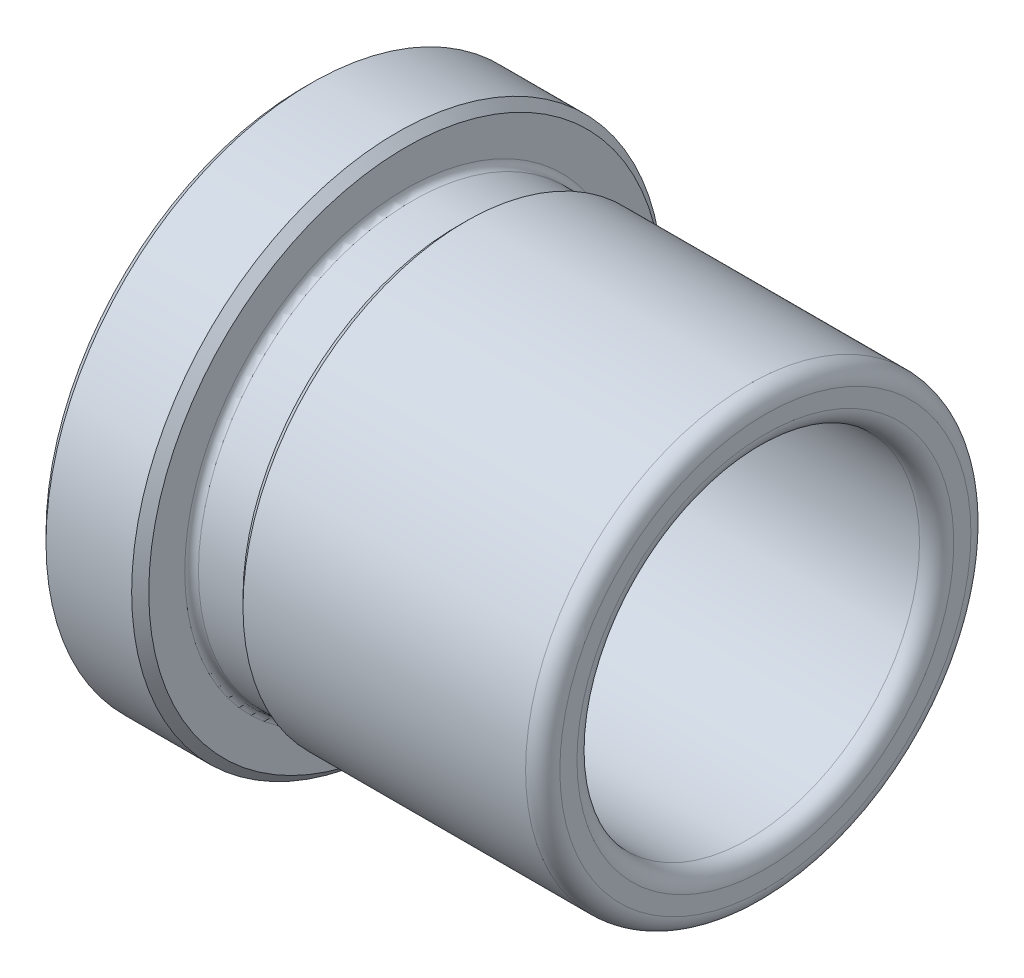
SolidWorks part; units mm, degrees
ref_plane "Plano frontal" through (0, 0, 0) normal (0, 0, 1) x (1, 0, 0)
ref_plane "Plano superior" through (0, 0, 0) normal (0, 1, 0) x (1, 0, 0)
ref_plane "Plano direito" through (0, 0, 0) normal (1, 0, 0) x (0, 0, -1)
sketch "Esboço1" plane through (0, 0, 0) normal (0, 0, 1) x (1, 0, 0)
  line L0 (0, 11) -> (0, 15)
  line L1 (0, 15) -> (0.5, 15.5)
  line L2 (0.5, 15.5) -> (5.5, 15.5)
  line L3 (5.5, 15.5) -> (6, 15)
  line L4 (6, 15) -> (6, 12.9)
  line L5 (6.4, 12.5) -> (9, 12.5)
  line L6 (9, 12.5) -> (9.5, 13)
  line L7 (9.5, 13) -> (26, 13)
  line L8 (27, 12) -> (27, 11)
  line L9 (26, 10) -> (1, 10)
  line L10 (0, 0) -> (32.5681, 0) construction
  arc A0 (6.4, 12.5) -> (6, 12.9) centre (6.4, 12.9) cw
  arc A1 (26, 13) -> (27, 12) centre (26, 12) cw
  arc A2 (27, 11) -> (26, 10) centre (26, 11) cw
  arc A3 (0, 11) -> (1, 10) centre (1, 11) ccw
  dimension "D11" = 0.4
  dimension "D13" = 1
  dimension "D14" = 1
  dimension "D15" = 1
  dimension "D1" = 27
  dimension "D2" = 6
  dimension "D3" = 31
  dimension "D4" = 20
  dimension "D5" = 26
  dimension "D6" = 0.5
  dimension "D7" = 45
  dimension "D8" = 0.5
  dimension "D9" = 0.5
  dimension "D10" = 3
  dimension "D12" = 45
revolve "Revolução1" add sketch "Esboço1" angle 360 about L10
sketch "Esboço2"
wrap "Envolver1" sketch "Esboço2" wrap type deboss source sketch "Esboço2" thickness 0.1 parameters "D1"=0.1
